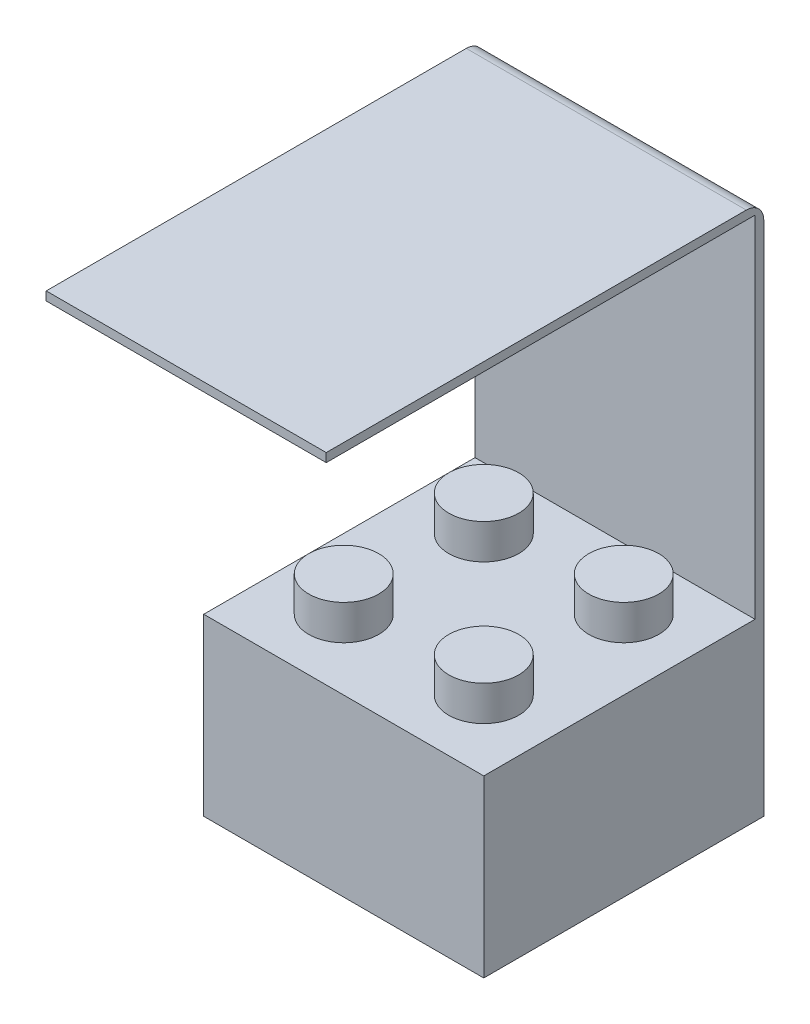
SolidWorks part; units mm, degrees
ref_plane "Front Plane" through (0, 0, 0) normal (0, 0, 1) x (1, 0, 0)
ref_plane "Top Plane" through (0, 0, 0) normal (0, 1, 0) x (1, 0, 0)
ref_plane "Right Plane" through (0, 0, 0) normal (1, 0, 0) x (0, 0, -1)
sketch "Croquis1" plane through (0, 0, 0) normal (0, 1, 0) x (1, 0, 0)
  line L1 (-8, 8) -> (8, 8)
  line L2 (-8, 8) -> (-8, -8)
  line L3 (-8, -8) -> (8, -8)
  line L4 (8, 8) -> (8, -8)
  line L5 (-8, 8) -> (8, -8) construction
  line L6 (-8, -8) -> (8, 8) construction
  point P0 (0, 0)
  dimension "D1" = 16
  dimension "D2" = 16
extrude "Saliente-Extruir1" add sketch "Croquis1" along normal blind 10
sketch "Croquis2" plane through (0, 10, 0) normal (0, 1, 0) x (1, 0, 0)
  line L0 (8, 8) -> (-8, 8) construction
  line L1 (-8, 8) -> (-8, -8) construction
  line L2 (0, 8) -> (0, 0) construction
  line L4 (-8, 0) -> (0, 0) construction
  circle A0 centre (-4, 4) radius 2
  circle A1 centre (4, 4) radius 2
  circle A2 centre (4, -4) radius 2
  circle A3 centre (-4, -4) radius 2
  dimension "D1" = 4
  dimension "D2" = 4
  dimension "D3" = 4
extrude "Saliente-Extruir2" add sketch "Croquis2" along normal blind 2
shell "Vaciado1" thickness 1
sketch "Croquis3" plane through (0, 9, 0) normal (0, -1, 0) x (-1, 0, 0)
  circle A0 centre (0, 0) radius 2.7
  circle A1 centre (0, 0) radius 1.7
  dimension "D1" = 5.4
  dimension "D2" = 1
extrude "Saliente-Extruir3" add sketch "Croquis3" along normal blind 9
sketch "Croquis4" plane through (0, 10, 0) normal (0, 1, 0) x (1, 0, 0)
  line L0 (-8, 8) -> (8, 8)
  line L1 (-7.5, 7.5) -> (7.5, 7.5)
  line L3 (7.5, 7.5) -> (8, 7.5)
  line L7 (8, 8) -> (8, 7.5)
  line L9 (-8, 8) -> (-8, 7.5)
  line L13 (-7.5, -7.5) -> (7.5, -7.5) construction
  line L14 (-8, -8) -> (8, -8) construction
  line L15 (-7.5, 7.5) -> (-8, 7.5)
  line L16 (8, 8) -> (8, -8) construction
  line L17 (-8, 8) -> (-8, -8) construction
  line L18 (7.5, 7.5) -> (7.5, -7.5) construction
  line L19 (-7.5, 7.5) -> (-7.5, -7.5) construction
  point P0 (0, 0)
  dimension "D3" = 0.5
extrude "Saliente-Extruir4" add sketch "Croquis4" along normal blind 20
sketch "Croquis5" plane through (0, 30, 0) normal (0, 1, 0) x (1, 0, 0)
  line L0 (8, 7.5) -> (8, 8) construction
  line L1 (-8, 8) -> (8, 8)
  line L2 (-8, 8) -> (-8, -17)
  line L3 (-8, -17) -> (8, -17)
  line L4 (8, 8) -> (8, -17)
  dimension "D1" = 25
extrude "Saliente-Extruir5" add sketch "Croquis5" along normal blind 0.5
fillet "Redondeo1" radius 1 1 edges at (0, 30.5, -8)
